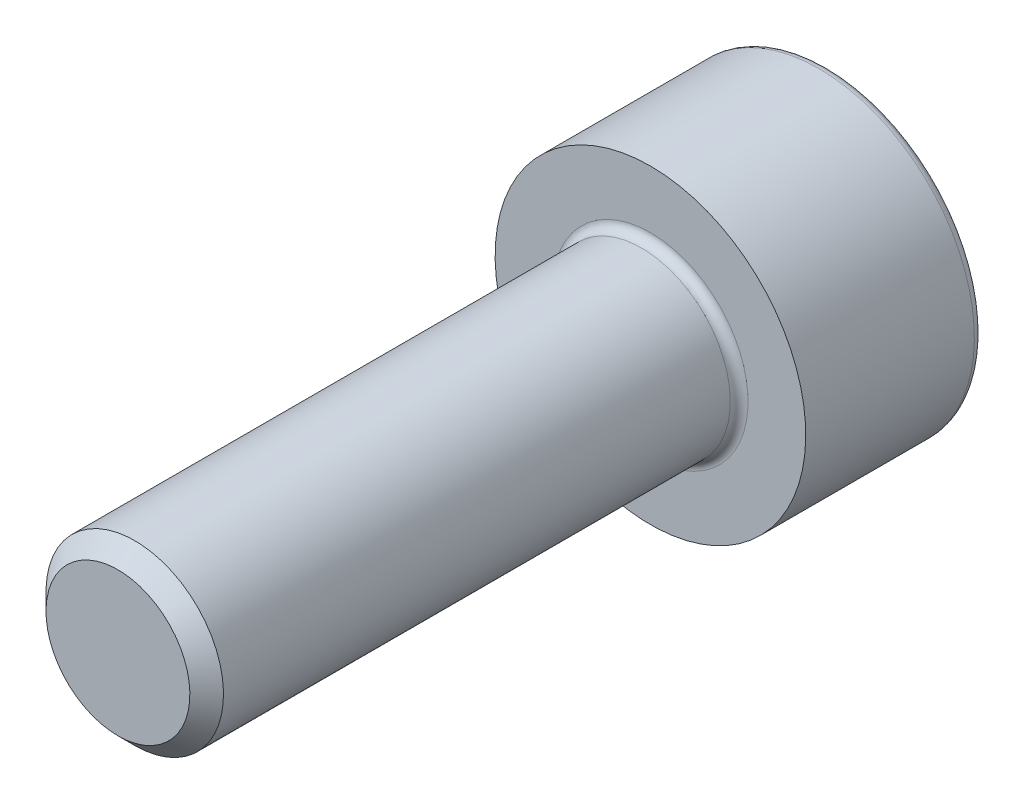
SolidWorks part; units mm, degrees
ref_plane "Plan1" through (0, 0, 0) normal (0, 0, 1) x (1, 0, 0)
ref_plane "Plan2" through (0, 0, 0) normal (0, 1, 0) x (1, 0, 0)
ref_plane "Plan3" through (0, 0, 0) normal (1, 0, 0) x (0, 0, -1)
sketch "Sketch1" plane through (0, 0, 0) normal (1, 0, 0) x (0, 0, -1)
  line L0 (4, 0) -> (-12, 0) construction
  line L1 (4, 0) -> (4, 3.5)
  line L2 (4, 3.5) -> (0, 3.5)
  line L3 (0, 3.5) -> (0, 2)
  line L4 (0, 2) -> (-12, 2)
  line L5 (-12, 2) -> (-12, 0)
  line L6 (-12, 0) -> (4, 0)
  line L7 (4, 0) -> (3.3, 0) construction
  dimension "DK" = 7
  dimension "L" = 12
  dimension "K" = 4
  dimension "D" = 4
  dimension "P" = 0.7
revolve "Base-Revolve" add sketch "Sketch1"
chamfer "Chamfer1" distance 0.3789 angle 45
fillet "Fillet1" radius 0.2
hole_wizard "Hole1" positions "Sketch3" profile "Sketch2" legacy
sketch "Sketch3" plane through (0, 0, -4) normal (0, 0, -1) x (-1, 0, 0)
  circle A0 centre (0, 0) radius 3.5 construction
  point P0 (0, 0)
sketch "Sketch2" plane through (0, 0, -4) normal (1, 0, 0) x (0, 1, 0)
  line L0 (0, 0) -> (0, 2.866)
  line L1 (0, 2.866) -> (1.5, 2)
  line L2 (1.5, 2) -> (1.5, 0)
  line L4 (1.5, 0) -> (0, 0)
  line L6 (0, 2.866) -> (-1.5, 2) construction
  line L7 (0, -4.2442) -> (0, 117.3081) construction
  dimension "Diameter" = 3
  dimension "Depth" = 2
  dimension "Drill Angle" = 120
sketch "Sketch4" plane through (0, 0, -4) normal (0, 0, -1) x (-1, 0, 0)
  line L0 (0, -1.5) -> (0, 1.5) construction
  line L1 (1.7321, 0) -> (-1.7321, 0) construction
  line L2 (0.866, 1.5) -> (-0.866, 1.5)
  line L3 (-0.866, 1.5) -> (-1.7321, 0)
  line L4 (-1.7321, 0) -> (-0.866, -1.5)
  line L5 (-0.866, -1.5) -> (0.866, -1.5)
  line L6 (0.866, -1.5) -> (1.7321, 0)
  line L7 (1.7321, 0) -> (0.866, 1.5)
  dimension "D1" = 120
  dimension "S" = 3
extrude "Cut-Extrude1" cut sketch "Sketch4" against normal blind 2
equation "\"K@Sketch1\" = \"D@Sketch1\""
equation "\"D1@Fillet1\" = \"D@Sketch1\"*0.05"
equation "\"S@Sketch4\" = \"Diameter@Sketch2\""
equation "\"T@Cut-Extrude1\" = \"Depth@Sketch2\""
equation "\"D1@Cosmetic_Thread1\" = \"D@Sketch1\"-(1.0825*\"P@Sketch1\")"
equation "\"D1@Chamfer1\" = (\"D@Sketch1\"-\"D1@Cosmetic_Thread1\")/2"
